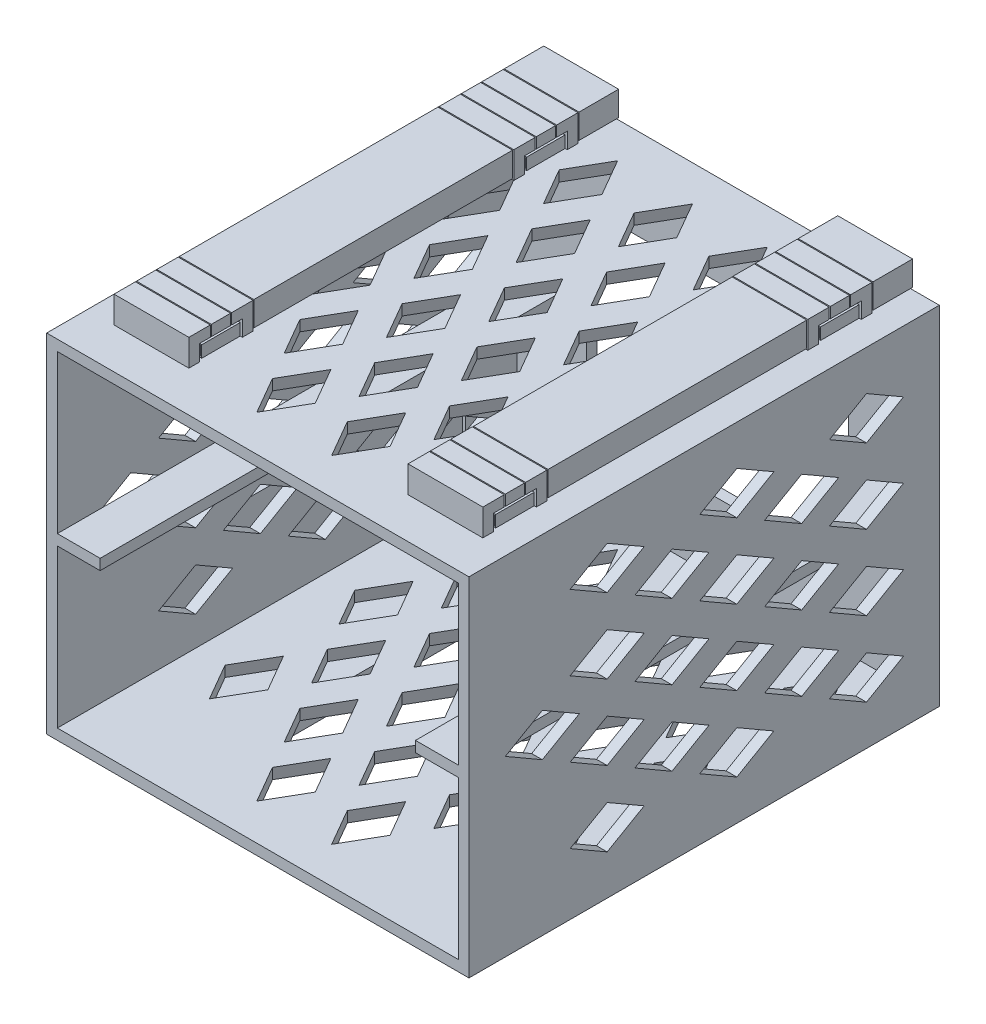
SolidWorks part; units mm, degrees
ref_plane "Alzado" through (0, 0, 0) normal (0, 0, 1) x (1, 0, 0)
ref_plane "Planta" through (0, 0, 0) normal (0, 1, 0) x (1, 0, 0)
ref_plane "Vista lateral" through (0, 0, 0) normal (1, 0, 0) x (0, 0, -1)
sketch "Croquis1" plane through (0, 0, 0) normal (0, 0, -1) x (-1, 0, 0)
  line L1 (-39.5, 32.5) -> (39.5, 32.5)
  line L2 (-39.5, 32.5) -> (-39.5, -32.5)
  line L3 (-39.5, -32.5) -> (39.5, -32.5)
  line L4 (39.5, 32.5) -> (39.5, -32.5)
  line L7 (-24.5, 17.5) -> (24.5, 17.5)
  line L8 (-24.5, 17.5) -> (-24.5, -17.5)
  line L9 (-24.5, -17.5) -> (24.5, -17.5)
  line L10 (24.5, 17.5) -> (24.5, -17.5)
extrude "Fondo" add sketch "Croquis1" against normal blind 2 separate body
sketch "Croquis3" plane through (0, 0, 2) normal (0, 0, 1) x (1, 0, 0)
  line L1 (-39.5, 32.5) -> (39.5, 32.5)
  line L2 (-39.5, 32.5) -> (-39.5, -32.5)
  line L3 (-39.5, -32.5) -> (39.5, -32.5)
  line L4 (39.5, 32.5) -> (39.5, -32.5)
  line L6 (-37.5, 30.5) -> (-37.5, -30.5)
  line L7 (-37.5, 30.5) -> (37.5, 30.5)
  line L8 (37.5, 30.5) -> (37.5, -30.5)
  line L9 (-37.5, -30.5) -> (37.5, -30.5)
extrude "Estructura" add sketch "Croquis3" along normal blind 86
sketch "Croquis5" plane through (-39.5, 0, 0) normal (-1, 0, 0) x (0, 0, 1)
  line L0 (13.628, 25) -> (20.556, 21)
  line L1 (20.556, 21) -> (13.628, 17)
  line L2 (13.628, 17) -> (6.7, 21)
  line L3 (6.7, 21) -> (13.628, 25)
  line L4 (0, -32.5) -> (0, 32.5) construction
  line L5 (88, 32.5) -> (0, 32.5) construction
  line L6 (13.628, 11) -> (20.556, 7)
  line L7 (6.7, 7) -> (13.628, 11)
  line L8 (13.628, 3) -> (6.7, 7)
  line L9 (20.556, 7) -> (13.628, 3)
  line L10 (13.628, -3) -> (20.556, -7)
  line L11 (6.7, -7) -> (13.628, -3)
  line L12 (13.628, -11) -> (6.7, -7)
  line L13 (20.556, -7) -> (13.628, -11)
  line L14 (13.628, -17) -> (20.556, -21)
  line L15 (6.7, -21) -> (13.628, -17)
  line L16 (13.628, -25) -> (6.7, -21)
  line L17 (20.556, -21) -> (13.628, -25)
  line L18 (37.884, 25) -> (44.812, 21)
  line L19 (44.812, 21) -> (37.884, 17)
  line L20 (37.884, 17) -> (30.956, 21)
  line L21 (30.956, 21) -> (37.884, 25)
  line L22 (44.812, 7) -> (37.884, 3)
  line L23 (37.884, 11) -> (44.812, 7)
  line L24 (30.956, 7) -> (37.884, 11)
  line L25 (37.884, 3) -> (30.956, 7)
  line L26 (44.812, -7) -> (37.884, -11)
  line L27 (37.884, -3) -> (44.812, -7)
  line L28 (30.956, -7) -> (37.884, -3)
  line L29 (37.884, -11) -> (30.956, -7)
  line L30 (37.884, -17) -> (44.812, -21)
  line L31 (44.812, -21) -> (37.884, -25)
  line L32 (37.884, -25) -> (30.956, -21)
  line L33 (30.956, -21) -> (37.884, -17)
  line L34 (62.14, 25) -> (69.068, 21)
  line L35 (69.068, 21) -> (62.14, 17)
  line L36 (62.14, 17) -> (55.212, 21)
  line L37 (55.212, 21) -> (62.14, 25)
  line L38 (69.068, 7) -> (62.14, 3)
  line L39 (62.14, 11) -> (69.068, 7)
  line L40 (55.212, 7) -> (62.14, 11)
  line L41 (62.14, 3) -> (55.212, 7)
  line L42 (69.068, -7) -> (62.14, -11)
  line L43 (62.14, -3) -> (69.068, -7)
  line L44 (55.212, -7) -> (62.14, -3)
  line L45 (62.14, -11) -> (55.212, -7)
  line L46 (62.14, -17) -> (69.068, -21)
  line L47 (69.068, -21) -> (62.14, -25)
  line L48 (62.14, -25) -> (55.212, -21)
  line L49 (55.212, -21) -> (62.14, -17)
  line L66 (50.012, 18) -> (56.94, 14)
  line L67 (56.94, 14) -> (50.012, 10)
  line L68 (50.012, 10) -> (43.084, 14)
  line L69 (43.084, 14) -> (50.012, 18)
  line L70 (50.012, 4) -> (56.94, 0)
  line L71 (43.084, 0) -> (50.012, 4)
  line L72 (50.012, -4) -> (43.084, 0)
  line L73 (56.94, -14) -> (50.012, -18)
  line L74 (50.012, -10) -> (56.94, -14)
  line L75 (43.084, -14) -> (50.012, -10)
  line L76 (18.828, 14) -> (25.756, 18)
  line L77 (67.34, 14) -> (74.268, 18) construction
  line L78 (67.34, -14) -> (74.268, -10) construction
  line L79 (74.268, -18) -> (67.34, -14) construction
  line L80 (25.756, 4) -> (32.684, 0)
  line L81 (18.828, 0) -> (25.756, 4)
  line L82 (25.756, -4) -> (18.828, 0)
  line L83 (32.684, 0) -> (25.756, -4)
  line L84 (25.756, -18) -> (18.828, -14)
  line L85 (32.684, -14) -> (25.756, -18)
  line L86 (56.94, 0) -> (50.012, -4)
  line L87 (50.012, -18) -> (43.084, -14)
  line L88 (32.684, 14) -> (25.756, 10)
  line L89 (25.756, 10) -> (18.828, 14)
  line L90 (25.756, 18) -> (32.684, 14)
  line L91 (74.268, 18) -> (81.196, 14) construction
  line L92 (81.196, 14) -> (74.268, 10) construction
  line L93 (74.268, 10) -> (67.34, 14) construction
  line L94 (81.196, 0) -> (74.268, -4)
  line L95 (74.268, 4) -> (81.196, 0)
  line L96 (67.34, 0) -> (74.268, 4)
  line L97 (74.268, -4) -> (67.34, 0)
  line L98 (81.196, -14) -> (74.268, -18) construction
  line L99 (74.268, -10) -> (81.196, -14) construction
  line L100 (25.756, -10) -> (32.684, -14)
  line L101 (18.828, -14) -> (25.756, -10)
  line L102 (88, 32.5) -> (0, 32.5) construction
  line L103 (86.396, 25) -> (93.324, 21)
  line L104 (93.324, 21) -> (86.396, 17)
  line L105 (86.396, 17) -> (79.468, 21)
  line L106 (79.468, 21) -> (86.396, 25)
  line L107 (93.324, 7) -> (86.396, 3)
  line L108 (86.396, 11) -> (93.324, 7)
  line L109 (79.468, 7) -> (86.396, 11)
  line L110 (86.396, 3) -> (79.468, 7)
  line L111 (93.324, -7) -> (86.396, -11)
  line L112 (86.396, -3) -> (93.324, -7)
  line L113 (79.468, -7) -> (86.396, -3)
  line L114 (86.396, -11) -> (79.468, -7)
  line L115 (86.396, -17) -> (93.324, -21)
  line L116 (93.324, -21) -> (86.396, -25)
  line L117 (86.396, -25) -> (79.468, -21)
  line L118 (79.468, -21) -> (86.396, -17)
  dimension "D1" = 7.9998
  dimension "D2" = 7.9998
  dimension "D3" = 6.7
  dimension "D4" = 7.5
  dimension "D5" = 8
  dimension "D7" = 13.856
  dimension "D9" = 24.256
  dimension "D10" = 14.5
  dimension "D11" = 24.256
  dimension "D6" = 4
  dimension "D8" = 4
extrude "RombosHor" cut sketch "Croquis5" against normal up to surface (79 mm away)
sketch "Croquis9" plane through (0, 32.5, 0) normal (0, 1, 0) x (1, 0, 0)
  line L0 (28, -6.6872) -> (24, -13.6154)
  line L1 (28, -6.6872) -> (32, -13.6154)
  line L2 (24, -13.6154) -> (28, -20.5436)
  line L3 (32, -13.6154) -> (28, -20.5436)
  line L4 (14, -6.6872) -> (10, -13.6154)
  line L5 (14, -6.6872) -> (18, -13.6154)
  line L6 (18, -13.6154) -> (14, -20.5436)
  line L7 (10, -13.6154) -> (14, -20.5436)
  line L8 (0, -6.6872) -> (-4, -13.6154)
  line L9 (0, -6.6872) -> (4, -13.6154)
  line L10 (4, -13.6154) -> (0, -20.5436)
  line L11 (-4, -13.6154) -> (0, -20.5436)
  line L12 (-14, -6.6872) -> (-18, -13.6154)
  line L13 (-14, -6.6872) -> (-10, -13.6154)
  line L14 (-10, -13.6154) -> (-14, -20.5436)
  line L15 (-18, -13.6154) -> (-14, -20.5436)
  line L16 (-28, -6.6872) -> (-32, -13.6154)
  line L17 (-28, -6.6872) -> (-24, -13.6154)
  line L18 (-24, -13.6154) -> (-28, -20.5436)
  line L19 (-32, -13.6154) -> (-28, -20.5436)
  line L20 (14, -30.9436) -> (10, -37.8718)
  line L21 (14, -30.9436) -> (18, -37.8718)
  line L22 (18, -37.8718) -> (14, -44.8)
  line L23 (10, -37.8718) -> (14, -44.8)
  line L24 (0, -30.9436) -> (-4, -37.8718)
  line L25 (0, -30.9436) -> (4, -37.8718)
  line L26 (4, -37.8718) -> (0, -44.8)
  line L27 (-4, -37.8718) -> (0, -44.8)
  line L28 (-14, -30.9436) -> (-18, -37.8718)
  line L29 (-14, -30.9436) -> (-10, -37.8718)
  line L30 (-10, -37.8718) -> (-14, -44.8)
  line L31 (-18, -37.8718) -> (-14, -44.8)
  line L32 (-28, -30.9436) -> (-32, -37.8718)
  line L33 (-28, -30.9436) -> (-24, -37.8718)
  line L34 (-24, -37.8718) -> (-28, -44.8)
  line L35 (-32, -37.8718) -> (-28, -44.8)
  line L36 (14, -55.2) -> (10, -62.1282)
  line L37 (14, -55.2) -> (18, -62.1282)
  line L38 (18, -62.1282) -> (14, -69.0564)
  line L39 (10, -62.1282) -> (14, -69.0564)
  line L40 (0, -55.2) -> (-4, -62.1282)
  line L41 (0, -55.2) -> (4, -62.1282)
  line L42 (4, -62.1282) -> (0, -69.0564)
  line L43 (-4, -62.1282) -> (0, -69.0564)
  line L44 (-14, -55.2) -> (-18, -62.1282)
  line L45 (-14, -55.2) -> (-10, -62.1282)
  line L46 (-10, -62.1282) -> (-14, -69.0564)
  line L47 (-18, -62.1282) -> (-14, -69.0564)
  line L48 (-28, -55.2) -> (-32, -62.1282)
  line L49 (-28, -55.2) -> (-24, -62.1282)
  line L50 (-24, -62.1282) -> (-28, -69.0564)
  line L51 (-32, -62.1282) -> (-28, -69.0564)
  line L68 (28, -30.9436) -> (24, -37.8718)
  line L69 (28, -30.9436) -> (32, -37.8718)
  line L70 (32, -37.8718) -> (28, -44.8)
  line L71 (24, -37.8718) -> (28, -44.8)
  line L72 (28, -55.2) -> (24, -62.1282)
  line L73 (28, -55.2) -> (32, -62.1282)
  line L74 (32, -62.1282) -> (28, -69.0564)
  line L75 (24, -62.1282) -> (28, -69.0564)
  line L80 (28, -6.6872) -> (14, -6.6872) construction
  line L81 (28, -6.6872) -> (28, -30.9436) construction
  line L83 (39.5, -88) -> (39.5, 0) construction
  line L87 (-39.5, 0) -> (39.5, 0) construction
  line L88 (17, -50.0018) -> (21, -56.93)
  line L89 (7, -67.33) -> (11, -74.2582)
  line L90 (-7, -67.33) -> (-11, -74.2582)
  line L91 (-7, -67.33) -> (-3, -74.2582)
  line L92 (-3, -74.2582) -> (-7, -81.1864)
  line L93 (-21, -67.33) -> (-25, -74.2582) construction
  line L94 (-21, -67.33) -> (-17, -74.2582) construction
  line L95 (-25, -74.2582) -> (-21, -81.1864) construction
  line L96 (21, -67.33) -> (25, -74.2582) construction
  line L97 (25, -74.2582) -> (21, -81.1864) construction
  line L98 (17, -74.2582) -> (21, -81.1864) construction
  line L99 (7, -18.8172) -> (3, -25.7454)
  line L100 (17, -25.7454) -> (21, -32.6736)
  line L101 (21, -18.8172) -> (25, -25.7454)
  line L102 (-7, -43.0736) -> (-11, -50.0018)
  line L103 (-3, -50.0018) -> (-7, -56.93)
  line L104 (-21, -43.0736) -> (-25, -50.0018)
  line L105 (-21, -43.0736) -> (-17, -50.0018)
  line L106 (-3, -25.7454) -> (-7, -32.6736)
  line L107 (-11, -25.7454) -> (-7, -32.6736)
  line L108 (-21, -18.8172) -> (-17, -25.7454)
  line L109 (-21, -18.8172) -> (-25, -25.7454)
  line L110 (-25, -25.7454) -> (-21, -32.6736)
  line L111 (21, -43.0736) -> (17, -50.0018)
  line L112 (11, -25.7454) -> (7, -32.6736)
  line L113 (7, -18.8172) -> (11, -25.7454)
  line L114 (7, -67.33) -> (3, -74.2582)
  line L115 (11, -74.2582) -> (7, -81.1864)
  line L116 (3, -74.2582) -> (7, -81.1864)
  line L117 (-11, -74.2582) -> (-7, -81.1864)
  line L118 (-17, -74.2582) -> (-21, -81.1864) construction
  line L119 (21, -67.33) -> (17, -74.2582) construction
  line L120 (7, -43.0736) -> (3, -50.0018)
  line L121 (7, -43.0736) -> (11, -50.0018)
  line L122 (11, -50.0018) -> (7, -56.93)
  line L123 (3, -50.0018) -> (7, -56.93)
  line L124 (21, -43.0736) -> (25, -50.0018)
  line L125 (25, -50.0018) -> (21, -56.93)
  line L126 (21, -18.8172) -> (17, -25.7454)
  line L127 (-7, -43.0736) -> (-3, -50.0018)
  line L128 (-11, -50.0018) -> (-7, -56.93)
  line L129 (-17, -50.0018) -> (-21, -56.93)
  line L130 (-25, -50.0018) -> (-21, -56.93)
  line L131 (-7, -18.8172) -> (-11, -25.7454)
  line L132 (-7, -18.8172) -> (-3, -25.7454)
  line L133 (-17, -25.7454) -> (-21, -32.6736)
  line L134 (3, -25.7454) -> (7, -32.6736)
  line L135 (25, -25.7454) -> (21, -32.6736)
  line L136 (18, -86.3846) -> (14, -93.3128)
  line L137 (10, -86.3846) -> (14, -93.3128)
  line L138 (4, -86.3846) -> (0, -93.3128)
  line L139 (-4, -86.3846) -> (0, -93.3128)
  line L140 (-10, -86.3846) -> (-14, -93.3128)
  line L141 (-18, -86.3846) -> (-14, -93.3128)
  line L142 (-24, -86.3846) -> (-28, -93.3128)
  line L143 (-32, -86.3846) -> (-28, -93.3128)
  line L144 (32, -86.3846) -> (28, -93.3128)
  line L145 (24, -86.3846) -> (28, -93.3128)
  line L146 (14, -79.4564) -> (10, -86.3846)
  line L147 (14, -79.4564) -> (18, -86.3846)
  line L148 (0, -79.4564) -> (-4, -86.3846)
  line L149 (0, -79.4564) -> (4, -86.3846)
  line L150 (-14, -79.4564) -> (-18, -86.3846)
  line L151 (-14, -79.4564) -> (-10, -86.3846)
  line L152 (-28, -79.4564) -> (-32, -86.3846)
  line L153 (-28, -79.4564) -> (-24, -86.3846)
  line L154 (28, -79.4564) -> (24, -86.3846)
  line L155 (28, -79.4564) -> (32, -86.3846)
  dimension "D1" = 8
  dimension "D2" = 8
  dimension "D3" = 8
  dimension "D4" = 13.8564
  dimension "D7" = 14
  dimension "D8" = 24.2564
  dimension "D9" = 6.6872
  dimension "D10" = 7.5
  dimension "D5" = 5
  dimension "D6" = 4
extrude "RombosVert" cut sketch "Croquis9" against normal up to surface (65 mm away)
sketch "Croquis8" plane through (0, 0, 2) normal (0, 0, 1) x (1, 0, 0)
  line L0 (-37.5, -30.5) -> (37.5, -30.5) construction
  line L1 (-29.5, -1) -> (-37.5, -1)
  line L2 (-29.5, -1) -> (-29.5, 1)
  line L3 (-29.5, 1) -> (-37.5, 1)
  line L4 (-37.5, -1) -> (-37.5, 1)
  line L5 (29.5, 1) -> (37.5, 1)
  line L6 (29.5, 1) -> (29.5, -1)
  line L7 (29.5, -1) -> (37.5, -1)
  line L8 (37.5, 1) -> (37.5, -1)
  dimension "D1" = 8
  dimension "D2" = 2
  dimension "D3" = 29.5
extrude "Guias" add sketch "Croquis8" along normal blind 86
sketch "Croquis10" plane through (39.5, 0, 0) normal (1, 0, 0) x (0, 0, -1)
  line L0 (-88, 32.5) -> (0, 32.5) construction
  line L1 (-12.104, -27.5) -> (-12.104, -13.5)
  line L2 (-15.104, -13.5) -> (-12.104, -13.5)
  line L3 (-15.104, -27.5) -> (-15.104, -13.5)
  line L4 (-15.104, -27.5) -> (-12.104, -27.5)
  line L5 (-88, 0) -> (0, 0) construction
  line L6 (-75.896, 27.5) -> (-75.896, 13.5)
  line L7 (-72.896, 13.5) -> (-75.896, 13.5)
  line L8 (-72.896, 27.5) -> (-72.896, 13.5)
  line L9 (0, 32.5) -> (0, -32.5) construction
  line L11 (-44, -32.5) -> (-44, 32.5) construction
  line L12 (-15.104, 27.5) -> (-12.104, 27.5)
  line L13 (-15.104, 27.5) -> (-15.104, 13.5)
  line L14 (-15.104, 13.5) -> (-12.104, 13.5)
  line L15 (-12.104, 27.5) -> (-12.104, 13.5)
  line L16 (-72.896, 27.5) -> (-75.896, 27.5)
  line L17 (-72.896, -27.5) -> (-75.896, -27.5)
  line L18 (-72.896, -27.5) -> (-72.896, -13.5)
  line L19 (-72.896, -13.5) -> (-75.896, -13.5)
  line L20 (-75.896, -27.5) -> (-75.896, -13.5)
  line L21 (-88, -32.5) -> (0, -32.5) construction
  dimension "D1" = 44
  dimension "D2" = 32.5
  dimension "D6" = 3
  dimension "D7" = 14
  dimension "D8" = 5
  dimension "D9" = 12.104
extrude "AncDer01" [suppressed] add sketch "Croquis10" along normal blind 2.5
sketch "Croquis11" [suppressed] plane through (42, 0, 0) normal (1, 0, 0) x (0, 0, -1)
  line L0 (-15.104, 13.5) -> (-12.104, 13.5) construction
  line L1 (0, 32.5) -> (0, -32.5) construction
  line L2 (-15.104, 27.5) -> (-15.104, 24.1478) construction
  line L3 (-17.104, 27.5) -> (-10.104, 27.5)
  line L4 (-17.104, 27.5) -> (-17.104, 13.5)
  line L5 (-44, 32.5) -> (-44, -32.5) construction
  line L6 (-12.104, 27.5) -> (-15.104, 27.5) construction
  line L7 (-10.104, -27.5) -> (-10.104, -13.5)
  line L8 (-17.104, 13.5) -> (-10.104, 13.5)
  line L9 (-17.104, -13.5) -> (-10.104, -13.5)
  line L10 (-88, 0) -> (0, 0) construction
  line L11 (-10.104, 27.5) -> (-10.104, 13.5)
  line L12 (-17.104, -27.5) -> (-17.104, -13.5)
  line L13 (-17.104, -27.5) -> (-10.104, -27.5)
  line L14 (-70.896, -27.5) -> (-77.896, -27.5)
  line L15 (-70.896, -27.5) -> (-70.896, -13.5)
  line L16 (-77.896, 27.5) -> (-77.896, 13.5)
  line L17 (-70.896, -13.5) -> (-77.896, -13.5)
  line L18 (-70.896, 13.5) -> (-77.896, 13.5)
  line L19 (-77.896, -27.5) -> (-77.896, -13.5)
  line L20 (-70.896, 27.5) -> (-70.896, 13.5)
  line L21 (-70.896, 27.5) -> (-77.896, 27.5)
  dimension "D1" = 44
  dimension "D2" = 88
  dimension "D3" = 7
  dimension "D4" = 2
extrude "AncDer02" [suppressed] add sketch "Croquis11" along normal blind 1.8
sketch "Croquis12" plane through (0, 32.5, 0) normal (0, 1, 0) x (1, 0, 0)
  line L1 (20.5, -9.604) -> (20.5, -7.604)
  line L2 (34.5, -7.604) -> (20.5, -7.604)
  line L3 (34.5, -9.604) -> (34.5, -7.604)
  line L4 (34.5, -9.604) -> (20.5, -9.604)
  line L5 (20.5, -19.604) -> (20.5, -17.604)
  line L6 (34.5, -17.604) -> (20.5, -17.604)
  line L7 (34.5, -19.604) -> (34.5, -17.604)
  line L8 (34.5, -19.604) -> (20.5, -19.604)
  line L10 (39.5, -44) -> (-39.5, -44) construction
  line L11 (-20.5, -78.396) -> (-20.5, -80.396)
  line L12 (-34.5, -80.396) -> (-20.5, -80.396)
  line L13 (0, -88) -> (0, 0) construction
  line L14 (-34.5, -78.396) -> (-34.5, -80.396)
  line L15 (-34.5, -78.396) -> (-20.5, -78.396)
  line L16 (-20.5, -68.396) -> (-20.5, -70.396)
  line L17 (-34.5, -70.396) -> (-20.5, -70.396)
  line L18 (-34.5, -68.396) -> (-34.5, -70.396)
  line L19 (-34.5, -68.396) -> (-20.5, -68.396)
  line L20 (34.5, -68.396) -> (20.5, -68.396)
  line L21 (-34.5, -19.604) -> (-20.5, -19.604)
  line L22 (-34.5, -19.604) -> (-34.5, -17.604)
  line L23 (-34.5, -17.604) -> (-20.5, -17.604)
  line L24 (-20.5, -19.604) -> (-20.5, -17.604)
  line L25 (-34.5, -9.604) -> (-20.5, -9.604)
  line L26 (-34.5, -9.604) -> (-34.5, -7.604)
  line L27 (-34.5, -7.604) -> (-20.5, -7.604)
  line L28 (-20.5, -9.604) -> (-20.5, -7.604)
  line L29 (34.5, -68.396) -> (34.5, -70.396)
  line L30 (34.5, -70.396) -> (20.5, -70.396)
  line L31 (20.5, -68.396) -> (20.5, -70.396)
  line L32 (34.5, -78.396) -> (20.5, -78.396)
  line L33 (34.5, -78.396) -> (34.5, -80.396)
  line L34 (34.5, -80.396) -> (20.5, -80.396)
  line L35 (20.5, -78.396) -> (20.5, -80.396)
  line L38 (-39.5, 0) -> (39.5, 0) construction
  line L39 (-39.5, -88) -> (-39.5, 0) construction
  dimension "D9" = 88
  dimension "D10" = 44
  dimension "D11" = 2
  dimension "D12" = 2
  dimension "D13" = 14
  dimension "D14" = 14
  dimension "D15" = 5
  dimension "D16" = 5
  dimension "D17" = 7.604
  dimension "D18" = 8
extrude "AncSup01" add sketch "Croquis12" along normal blind 3
sketch "Croquis13" plane through (0, 35.5, 0) normal (0, 1, 0) x (1, 0, 0)
  line L0 (39.5, -44) -> (-39.5, -44) construction
  line L2 (-39.5, 0) -> (39.5, 0) construction
  line L3 (-20.5, -9.604) -> (-20.5, -7.604) construction
  line L4 (-34.5, -7.604) -> (-20.5, -7.604)
  line L5 (-34.5, -7.604) -> (-34.5, -11.604)
  line L6 (-34.5, -11.604) -> (-20.5, -11.604)
  line L7 (-20.5, -7.604) -> (-20.5, -11.604)
  line L8 (-27.4575, -19.604) -> (-21.4543, -19.604) construction
  line L10 (-34.5, -19.604) -> (-20.5, -19.604)
  line L11 (0, 0) -> (0, -88) construction
  line L13 (-34.5, -19.604) -> (-34.5, -15.604)
  line L14 (-34.5, -15.604) -> (-20.5, -15.604)
  line L15 (-20.5, -19.604) -> (-20.5, -15.604)
  line L16 (-20.5, -19.604) -> (-20.5, -17.604) construction
  line L17 (20.5, -19.604) -> (20.5, -15.604)
  line L18 (34.5, -15.604) -> (20.5, -15.604)
  line L19 (34.5, -19.604) -> (34.5, -15.604)
  line L20 (34.5, -19.604) -> (20.5, -19.604)
  line L21 (20.5, -7.604) -> (20.5, -11.604)
  line L22 (34.5, -11.604) -> (20.5, -11.604)
  line L23 (34.5, -7.604) -> (34.5, -11.604)
  line L24 (34.5, -7.604) -> (20.5, -7.604)
  line L25 (34.5, -80.396) -> (20.5, -80.396)
  line L26 (34.5, -80.396) -> (34.5, -76.396)
  line L27 (34.5, -76.396) -> (20.5, -76.396)
  line L28 (20.5, -80.396) -> (20.5, -76.396)
  line L29 (34.5, -68.396) -> (20.5, -68.396)
  line L30 (34.5, -68.396) -> (34.5, -72.396)
  line L31 (34.5, -72.396) -> (20.5, -72.396)
  line L32 (20.5, -68.396) -> (20.5, -72.396)
  line L33 (-20.5, -68.396) -> (-20.5, -72.396)
  line L34 (-34.5, -72.396) -> (-20.5, -72.396)
  line L35 (-34.5, -68.396) -> (-34.5, -72.396)
  line L36 (-34.5, -68.396) -> (-20.5, -68.396)
  line L37 (-20.5, -80.396) -> (-20.5, -76.396)
  line L38 (-34.5, -76.396) -> (-20.5, -76.396)
  line L39 (-34.5, -80.396) -> (-34.5, -76.396)
  line L40 (-34.5, -80.396) -> (-20.5, -80.396)
  dimension "D1" = 44
  dimension "D2" = 88
  dimension "D3" = 4
  dimension "D4" = 4
extrude "AncSup02" add sketch "Croquis13" along normal blind 2
sketch "Croquis52" plane through (-39.5, 0, 0) normal (-1, 0, 0) x (0, 0, 1)
  line L0 (0, -32.5) -> (0, 32.5) construction
  line L1 (88, 32.5) -> (0, 32.5) construction
  line L2 (9.604, -27.5) -> (7.604, -27.5)
  line L3 (9.604, -27.5) -> (9.604, -13.5)
  line L4 (9.604, -13.5) -> (7.604, -13.5)
  line L5 (7.604, -27.5) -> (7.604, -13.5)
  line L6 (19.604, -27.5) -> (17.604, -27.5)
  line L7 (19.604, -27.5) -> (19.604, -13.5)
  line L8 (19.604, -13.5) -> (17.604, -13.5)
  line L9 (44, 32.5) -> (44, -32.5) construction
  line L10 (17.604, -27.5) -> (17.604, -13.5)
  line L11 (78.396, 27.5) -> (80.396, 27.5)
  line L12 (78.396, 27.5) -> (78.396, 13.5)
  line L13 (78.396, 13.5) -> (80.396, 13.5)
  line L14 (80.396, 27.5) -> (80.396, 13.5)
  line L15 (68.396, 27.5) -> (70.396, 27.5)
  line L16 (88, 0) -> (0, 0) construction
  line L17 (68.396, 27.5) -> (68.396, 13.5)
  line L18 (68.396, 13.5) -> (70.396, 13.5)
  line L19 (70.396, 27.5) -> (70.396, 13.5)
  line L20 (70.396, -27.5) -> (70.396, -13.5)
  line L21 (68.396, -13.5) -> (70.396, -13.5)
  line L22 (68.396, -27.5) -> (68.396, -13.5)
  line L23 (68.396, -27.5) -> (70.396, -27.5)
  line L24 (80.396, -27.5) -> (80.396, -13.5)
  line L25 (78.396, -13.5) -> (80.396, -13.5)
  line L26 (78.396, -27.5) -> (78.396, -13.5)
  line L27 (78.396, -27.5) -> (80.396, -27.5)
  line L32 (17.604, 27.5) -> (17.604, 13.5)
  line L33 (19.604, 13.5) -> (17.604, 13.5)
  line L34 (19.604, 27.5) -> (19.604, 13.5)
  line L35 (19.604, 27.5) -> (17.604, 27.5)
  line L36 (7.604, 27.5) -> (7.604, 13.5)
  line L37 (9.604, 13.5) -> (7.604, 13.5)
  line L38 (9.604, 27.5) -> (9.604, 13.5)
  line L39 (9.604, 27.5) -> (7.604, 27.5)
  dimension "D1" = 44
  dimension "D2" = 88
  dimension "D3" = 2
  dimension "D4" = 2
  dimension "D5" = 8
  dimension "D6" = 14
  dimension "D7" = 14
  dimension "D8" = 7.604
  dimension "D9" = 5
  dimension "D10" = 5
extrude "AncIzq01" add sketch "Croquis52" along normal blind 3
sketch "Croquis53" plane through (-42.5, 0, 0) normal (-1, 0, 0) x (0, 0, 1)
  line L0 (44, 32.5) -> (44, -32.5) construction
  line L1 (0, -32.5) -> (0, 32.5) construction
  line L2 (7.604, 13.5) -> (9.604, 13.5) construction
  line L3 (7.604, 27.5) -> (11.604, 27.5)
  line L4 (7.604, 27.5) -> (7.604, 13.5)
  line L5 (7.604, 13.5) -> (11.604, 13.5)
  line L6 (11.604, 27.5) -> (11.604, 13.5)
  line L7 (17.604, 13.5) -> (19.604, 13.5) construction
  line L8 (19.604, 27.5) -> (15.604, 27.5)
  line L10 (19.604, 27.5) -> (19.604, 13.5)
  line L12 (88, 0) -> (0, 0) construction
  line L13 (19.604, 13.5) -> (15.604, 13.5)
  line L14 (15.604, 27.5) -> (15.604, 13.5)
  line L15 (15.604, -27.5) -> (15.604, -13.5)
  line L16 (19.604, -13.5) -> (15.604, -13.5)
  line L17 (19.604, -27.5) -> (19.604, -13.5)
  line L18 (19.604, -27.5) -> (15.604, -27.5)
  line L19 (11.604, -27.5) -> (11.604, -13.5)
  line L20 (7.604, -13.5) -> (11.604, -13.5)
  line L21 (7.604, -27.5) -> (7.604, -13.5)
  line L22 (7.604, -27.5) -> (11.604, -27.5)
  line L23 (80.396, -27.5) -> (76.396, -27.5)
  line L24 (80.396, -27.5) -> (80.396, -13.5)
  line L25 (80.396, -13.5) -> (76.396, -13.5)
  line L26 (76.396, -27.5) -> (76.396, -13.5)
  line L27 (68.396, -27.5) -> (72.396, -27.5)
  line L28 (68.396, -27.5) -> (68.396, -13.5)
  line L29 (68.396, -13.5) -> (72.396, -13.5)
  line L30 (72.396, -27.5) -> (72.396, -13.5)
  line L31 (72.396, 27.5) -> (72.396, 13.5)
  line L32 (68.396, 13.5) -> (72.396, 13.5)
  line L33 (68.396, 27.5) -> (68.396, 13.5)
  line L34 (68.396, 27.5) -> (72.396, 27.5)
  line L35 (76.396, 27.5) -> (76.396, 13.5)
  line L36 (80.396, 13.5) -> (76.396, 13.5)
  line L37 (80.396, 27.5) -> (80.396, 13.5)
  line L38 (80.396, 27.5) -> (76.396, 27.5)
  dimension "D1" = 44
  dimension "D2" = 88
  dimension "D3" = 4
  dimension "D4" = 4
extrude "AncIzq02" add sketch "Croquis53" along normal blind 2
sketch "Croquis54" plane through (0, -32.5, 0) normal (0, -1, 0) x (1, 0, 0)
  line L0 (0, 88) -> (0, 0) construction
  line L1 (-34.5, 15.104) -> (-20.5, 15.104)
  line L2 (-34.5, 15.104) -> (-34.5, 12.104)
  line L3 (-34.5, 12.104) -> (-20.5, 12.104)
  line L4 (-20.5, 15.104) -> (-20.5, 12.104)
  line L5 (-39.5, 88) -> (39.5, 88) construction
  line L6 (-39.5, 44) -> (39.5, 44) construction
  line L7 (-39.5, 88) -> (-39.5, 0) construction
  line L8 (39.5, 88) -> (39.5, 0) construction
  line L9 (39.5, 0) -> (-39.5, 0) construction
  line L10 (20.5, 15.104) -> (20.5, 12.104)
  line L11 (34.5, 12.104) -> (20.5, 12.104)
  line L12 (34.5, 15.104) -> (34.5, 12.104)
  line L13 (34.5, 15.104) -> (20.5, 15.104)
  line L14 (34.5, 72.896) -> (20.5, 72.896)
  line L15 (34.5, 72.896) -> (34.5, 75.896)
  line L16 (34.5, 75.896) -> (20.5, 75.896)
  line L17 (20.5, 72.896) -> (20.5, 75.896)
  line L18 (-20.5, 72.896) -> (-20.5, 75.896)
  line L19 (-34.5, 75.896) -> (-20.5, 75.896)
  line L20 (-34.5, 72.896) -> (-34.5, 75.896)
  line L21 (-34.5, 72.896) -> (-20.5, 72.896)
  dimension "D1" = 3
  dimension "D2" = 14
  dimension "D3" = 5
  dimension "D4" = 12.104
extrude "AncInf01" add sketch "Croquis54" along normal blind 2.5
sketch "Croquis55" plane through (0, -35, 0) normal (0, -1, 0) x (1, 0, 0)
  line L1 (-34.5, 77.896) -> (-20.5, 77.896)
  line L2 (-34.5, 77.896) -> (-34.5, 70.896)
  line L3 (-34.5, 70.896) -> (-20.5, 70.896)
  line L4 (-20.5, 77.896) -> (-20.5, 70.896)
  line L6 (-20.5, 72.896) -> (-20.5, 75.896) construction
  line L7 (-34.5, 75.896) -> (-34.5, 72.896) construction
  line L8 (-34.5, 72.896) -> (-20.5, 72.896) construction
  line L9 (-39.5, 44) -> (39.5, 44) construction
  line L10 (-39.5, 88) -> (-39.5, 0) construction
  line L11 (39.5, 88) -> (39.5, 0) construction
  line L12 (0, 88) -> (0, 0) construction
  line L13 (-39.5, 88) -> (39.5, 88) construction
  line L14 (20.5, 77.896) -> (20.5, 70.896)
  line L15 (34.5, 70.896) -> (20.5, 70.896)
  line L16 (34.5, 77.896) -> (34.5, 70.896)
  line L17 (34.5, 77.896) -> (20.5, 77.896)
  line L18 (34.5, 10.104) -> (20.5, 10.104)
  line L19 (34.5, 10.104) -> (34.5, 17.104)
  line L20 (34.5, 17.104) -> (20.5, 17.104)
  line L21 (20.5, 10.104) -> (20.5, 17.104)
  line L22 (-20.5, 10.104) -> (-20.5, 17.104)
  line L23 (-34.5, 17.104) -> (-20.5, 17.104)
  line L24 (-34.5, 10.104) -> (-34.5, 17.104)
  line L25 (-34.5, 10.104) -> (-20.5, 10.104)
  dimension "D1" = 7
  dimension "D2" = 2
extrude "AncInf02" add sketch "Croquis55" along normal blind 1.8
sketch "Croquis61" plane through (0, 0, 0) normal (0, 0, -1) x (-1, 0, 0)
  line L1 (20.5, 32.9) -> (34.5, 32.9)
  line L2 (20.5, 32.9) -> (20.5, 37.5)
  line L3 (20.5, 37.5) -> (34.5, 37.5)
  line L4 (34.5, 32.9) -> (34.5, 37.5)
  line L5 (20.7, 33.1) -> (20.7, 37.3)
  line L6 (20.7, 37.3) -> (34.3, 37.3)
  line L7 (34.3, 33.1) -> (34.3, 37.3)
  line L8 (20.7, 33.1) -> (34.3, 33.1)
  line L9 (0, 32.5) -> (0, 17.5) construction
  line L10 (39.5, 32.5) -> (-39.5, 32.5) construction
  line L11 (24.5, 17.5) -> (-24.5, 17.5) construction
  line L12 (-20.7, 33.1) -> (-34.3, 33.1)
  line L13 (-34.3, 33.1) -> (-34.3, 37.3)
  line L14 (-20.7, 37.3) -> (-34.3, 37.3)
  line L15 (-20.7, 33.1) -> (-20.7, 37.3)
  line L16 (-34.5, 32.9) -> (-34.5, 37.5)
  line L17 (-20.5, 37.5) -> (-34.5, 37.5)
  line L18 (-20.5, 32.9) -> (-20.5, 37.5)
  line L19 (-20.5, 32.9) -> (-34.5, 32.9)
  dimension "D1" = 0.2
extrude "EspAncSup01" add sketch "Croquis61" against normal blind 7.404 separate body
ref_plane "PlanoEspAncSup01" through (0, 0, 19.804) normal (0, 0, 1) x (1, 0, 0)
sketch "Croquis57" plane through (0, 0, 19.804) normal (0, 0, 1) x (1, 0, 0)
  line L1 (34.5, 37.5) -> (20.5457, 37.5)
  line L2 (34.5, 37.5) -> (34.5, 32.9)
  line L3 (34.5, 32.9) -> (20.5457, 32.9)
  line L4 (20.5457, 37.5) -> (20.5457, 32.9)
  line L5 (34.3, 37.3) -> (34.3, 33.1)
  line L6 (34.3, 33.1) -> (20.7457, 33.1)
  line L7 (20.7457, 37.3) -> (20.7457, 33.1)
  line L8 (34.3, 37.3) -> (20.7457, 37.3)
  line L9 (0, 32.5) -> (0, 17.5) construction
  line L10 (-24.5, 17.5) -> (24.5, 17.5) construction
  line L11 (-34.3, 37.3) -> (-20.7457, 37.3)
  line L12 (-20.7457, 37.3) -> (-20.7457, 33.1)
  line L13 (-34.3, 33.1) -> (-20.7457, 33.1)
  line L14 (-34.3, 37.3) -> (-34.3, 33.1)
  line L15 (-20.5457, 37.5) -> (-20.5457, 32.9)
  line L16 (-34.5, 32.9) -> (-20.5457, 32.9)
  line L17 (-34.5, 37.5) -> (-34.5, 32.9)
  line L18 (-34.5, 37.5) -> (-20.5457, 37.5)
  dimension "D1" = 0.2
sketch "Croquis58" plane through (0, 0, 19.804) normal (0, 0, 1) x (1, 0, 0)
  line L0 (33.8, 36.8) -> (33.8, 33.6)
  line L1 (0, 32.5) -> (0, 17.5) construction
  line L2 (-33.6, 36.6) -> (-21.4457, 36.6)
  line L3 (-21.4457, 36.6) -> (-21.4457, 33.8)
  line L4 (-33.6, 33.8) -> (-21.4457, 33.8)
  line L5 (33.8, 33.6) -> (21.2457, 33.6)
  line L6 (21.2457, 36.8) -> (21.2457, 33.6)
  line L7 (33.8, 36.8) -> (21.2457, 36.8)
  line L8 (33.6, 36.6) -> (33.6, 33.8)
  line L9 (33.6, 33.8) -> (21.4457, 33.8)
  line L10 (21.4457, 36.6) -> (21.4457, 33.8)
  line L11 (33.6, 36.6) -> (21.4457, 36.6)
  line L12 (-33.6, 36.6) -> (-33.6, 33.8)
  line L13 (-33.8, 36.8) -> (-21.2457, 36.8)
  line L14 (-21.2457, 36.8) -> (-21.2457, 33.6)
  line L15 (-33.8, 33.6) -> (-21.2457, 33.6)
  line L16 (-33.8, 36.8) -> (-33.8, 33.6)
  dimension "D2" = 0.2
sketch "Croquis59" plane through (0, 0, 19.804) normal (0, 0, 1) x (1, 0, 0)
  line L0 (33.1, 36.1) -> (33.1, 34.3)
  line L1 (0, 32.5) -> (0, 17.5) construction
  line L2 (-32.9, 35.9) -> (-22.1457, 35.9)
  line L3 (-22.1457, 35.9) -> (-22.1457, 34.5)
  line L4 (-32.9, 34.5) -> (-22.1457, 34.5)
  line L5 (33.1, 34.3) -> (21.9457, 34.3)
  line L6 (21.9457, 36.1) -> (21.9457, 34.3)
  line L7 (33.1, 36.1) -> (21.9457, 36.1)
  line L8 (32.9, 35.9) -> (32.9, 34.5)
  line L9 (32.9, 34.5) -> (22.1457, 34.5)
  line L10 (22.1457, 35.9) -> (22.1457, 34.5)
  line L11 (32.9, 35.9) -> (22.1457, 35.9)
  line L12 (-32.9, 35.9) -> (-32.9, 34.5)
  line L13 (-33.1, 36.1) -> (-21.9457, 36.1)
  line L14 (-21.9457, 36.1) -> (-21.9457, 34.3)
  line L15 (-33.1, 34.3) -> (-21.9457, 34.3)
  line L16 (-33.1, 36.1) -> (-33.1, 34.3)
  dimension "D2" = 0.2
extrude "EspAncSup02" add sketch "Croquis57" along normal blind 48.392
extrude "EspAncSup03" add sketch "Croquis58" along normal blind 48.392 separate body
extrude "EspAncSup04" add sketch "Croquis59" along normal blind 48.392 separate body
ref_plane "PlanoEspAncSup02" through (0, 32.9, 0) normal (0, 1, 0) x (1, 0, 0)
sketch "Croquis64" plane through (0, 32.9, 0) normal (0, 1, 0) x (1, 0, 0)
  line L0 (-34.5, -9.604) -> (-29.684, -9.604) construction
  line L1 (-20.5, -17.204) -> (-34.5, -17.204)
  line L2 (-20.5, -17.204) -> (-20.5, -10.004)
  line L3 (-20.5, -10.004) -> (-34.5, -10.004)
  line L4 (-34.5, -17.204) -> (-34.5, -10.004)
  line L5 (-29.6972, -17.604) -> (-34.5, -17.604) construction
  line L6 (-34.5, -7.604) -> (-34.5, -9.604) construction
  line L7 (-39.5, -44) -> (39.5, -44) construction
  line L8 (-39.5, -88) -> (-39.5, 0) construction
  line L9 (39.5, -88) -> (39.5, 0) construction
  line L10 (0, 0) -> (0, -88) construction
  line L11 (39.5, -88) -> (-39.5, -88) construction
  line L12 (34.5, -17.204) -> (34.5, -10.004)
  line L13 (20.5, -10.004) -> (34.5, -10.004)
  line L14 (20.5, -17.204) -> (20.5, -10.004)
  line L15 (20.5, -17.204) -> (34.5, -17.204)
  line L16 (20.5, -70.796) -> (34.5, -70.796)
  line L17 (20.5, -70.796) -> (20.5, -77.996)
  line L18 (20.5, -77.996) -> (34.5, -77.996)
  line L19 (34.5, -70.796) -> (34.5, -77.996)
  line L20 (-34.5, -70.796) -> (-34.5, -77.996)
  line L21 (-20.5, -77.996) -> (-34.5, -77.996)
  line L22 (-20.5, -70.796) -> (-20.5, -77.996)
  line L23 (-20.5, -70.796) -> (-34.5, -70.796)
  dimension "D1" = 0.4
  dimension "D2" = 0.4
  dimension "D3" = 14
extrude "EspAncSup05" add sketch "Croquis64" along normal blind 2.2
sketch "Croquis66" plane through (0, 0, 17.204) normal (0, 0, 1) x (1, 0, 0)
  line L0 (-34.3, 34.9) -> (-34.3, 33.1)
  line L1 (0, 17.5) -> (0, 30.5) construction
  line L2 (-24.5, 17.5) -> (24.5, 17.5) construction
  line L3 (37.5, 30.5) -> (-37.5, 30.5) construction
  line L4 (34.3, 34.9) -> (20.7, 34.9)
  line L5 (-34.3, 33.1) -> (-20.7, 33.1)
  line L6 (-20.7, 34.9) -> (-20.7, 33.1)
  line L7 (-34.3, 34.9) -> (-20.7, 34.9)
  line L8 (20.7, 34.9) -> (20.7, 33.1)
  line L9 (34.3, 33.1) -> (20.7, 33.1)
  line L10 (34.3, 34.9) -> (34.3, 33.1)
extrude "EspAncSup06" cut sketch "Croquis66" against normal up to next (7.2 mm away)
sketch "Croquis68" plane through (0, 0, 77.996) normal (0, 0, 1) x (1, 0, 0)
  line L0 (34.3, 34.9) -> (34.3, 33.1)
  line L1 (0, 17.5) -> (0, 32.5) construction
  line L2 (-24.5, 17.5) -> (24.5, 17.5) construction
  line L3 (-34.3, 34.9) -> (-20.7, 34.9)
  line L4 (-20.7, 34.9) -> (-20.7, 33.1)
  line L5 (34.3, 33.1) -> (20.7, 33.1)
  line L6 (20.7, 34.9) -> (20.7, 33.1)
  line L7 (34.3, 34.9) -> (20.7, 34.9)
  line L8 (-34.3, 33.1) -> (-20.7, 33.1)
  line L9 (-34.3, 34.9) -> (-34.3, 33.1)
extrude "EspAncSup07" cut sketch "Croquis68" against normal up to next (7.2 mm away)
sketch "Croquis70" plane through (0, 35.5, 0) normal (0, -1, 0) x (1, 0, 0)
  line L1 (20.5, 70.396) -> (20.5, 72.396) construction
  line L2 (20.5, 72.396) -> (34.5, 72.396) construction
  line L3 (34.5, 76.396) -> (20.5, 76.396) construction
  line L4 (34.5, 72.396) -> (34.5, 70.396) construction
  line L5 (-34.5, 76.196) -> (-34.5, 72.596)
  line L6 (-20.5, 72.596) -> (-34.5, 72.596)
  line L7 (-20.5, 76.196) -> (-20.5, 72.596)
  line L8 (0, 88) -> (0, 0) construction
  line L9 (39.5, 88) -> (-39.5, 88) construction
  line L10 (39.5, 44) -> (-39.5, 44) construction
  line L11 (39.5, 88) -> (39.5, 0) construction
  line L12 (-39.5, 88) -> (-39.5, 0) construction
  line L13 (-20.5, 76.196) -> (-34.5, 76.196)
  line L14 (34.5, 11.804) -> (34.5, 15.404)
  line L15 (20.5, 15.404) -> (34.5, 15.404)
  line L16 (20.5, 11.804) -> (20.5, 15.404)
  line L17 (20.5, 76.196) -> (34.5, 76.196)
  line L18 (20.5, 76.196) -> (20.5, 72.596)
  line L19 (20.5, 72.596) -> (34.5, 72.596)
  line L20 (34.5, 76.196) -> (34.5, 72.596)
  line L21 (20.5, 11.804) -> (34.5, 11.804)
  line L22 (-20.5, 11.804) -> (-34.5, 11.804)
  line L23 (-20.5, 11.804) -> (-20.5, 15.404)
  line L24 (-20.5, 15.404) -> (-34.5, 15.404)
  line L25 (-34.5, 11.804) -> (-34.5, 15.404)
  dimension "D1" = 0.2
  dimension "D2" = 0.2
extrude "EspAncSup08" add sketch "Croquis70" against normal blind 2 separate body
sketch "Croquis71" plane through (0, 0, 72.596) normal (0, 0, -1) x (-1, 0, 0)
  line L0 (-34.3, 37.3) -> (-34.3, 35.7)
  line L2 (0, 32.5) -> (0, 17.5) construction
  line L3 (39.5, 32.5) -> (-39.5, 32.5) construction
  line L4 (24.5, 17.5) -> (-24.5, 17.5) construction
  line L5 (-20.7, 35.7) -> (-34.3, 35.7)
  line L6 (-20.7, 37.3) -> (-20.7, 35.7)
  line L7 (-20.7, 37.3) -> (-34.3, 37.3)
  line L8 (20.7, 37.3) -> (34.3, 37.3)
  line L9 (20.7, 37.3) -> (20.7, 35.7)
  line L10 (20.7, 35.7) -> (34.3, 35.7)
  line L11 (34.3, 37.3) -> (34.3, 35.7)
extrude "EspAncSup09" cut sketch "Croquis71" against normal up to next (3.6 mm away)
sketch "Croquis72" plane through (0, 0, 11.804) normal (0, 0, -1) x (-1, 0, 0)
  line L0 (-34.3, 37.3) -> (-34.3, 35.7)
  line L1 (0, 32.5) -> (0, 17.5) construction
  line L2 (39.5, 32.5) -> (-39.5, 32.5) construction
  line L3 (24.5, 17.5) -> (-24.5, 17.5) construction
  line L4 (34.3, 37.3) -> (20.7, 37.3)
  line L5 (-34.3, 35.7) -> (-20.7, 35.7)
  line L6 (-20.7, 37.3) -> (-20.7, 35.7)
  line L7 (-34.3, 37.3) -> (-20.7, 37.3)
  line L8 (20.7, 37.3) -> (20.7, 35.7)
  line L9 (34.3, 35.7) -> (20.7, 35.7)
  line L10 (34.3, 37.3) -> (34.3, 35.7)
extrude "EspAncSup10" cut sketch "Croquis72" against normal up to next (3.6 mm away)
sketch "Croquis73" plane through (0, 0, 0) normal (0, 0, -1) x (-1, 0, 0)
  line L1 (39.9, 27.5) -> (44.5, 27.5)
  line L2 (39.9, 27.5) -> (39.9, 13.5)
  line L3 (39.9, 13.5) -> (44.5, 13.5)
  line L4 (44.5, 27.5) -> (44.5, 13.5)
  line L6 (39.5, 0) -> (24.5, 0) construction
  line L7 (39.5, -32.5) -> (39.5, 32.5) construction
  line L8 (24.5, -17.5) -> (24.5, 17.5) construction
  line L9 (40.1, -27.3) -> (40.1, -13.7)
  line L10 (40.1, -13.7) -> (44.3, -13.7)
  line L11 (44.3, -27.3) -> (44.3, -13.7)
  line L12 (40.1, -27.3) -> (44.3, -27.3)
  line L13 (40.1, 27.3) -> (44.3, 27.3)
  line L14 (44.3, 27.3) -> (44.3, 13.7)
  line L15 (40.1, 13.7) -> (44.3, 13.7)
  line L16 (40.1, 27.3) -> (40.1, 13.7)
  line L17 (44.5, -27.5) -> (44.5, -13.5)
  line L18 (39.9, -13.5) -> (44.5, -13.5)
  line L19 (39.9, -27.5) -> (39.9, -13.5)
  line L20 (39.9, -27.5) -> (44.5, -27.5)
  dimension "D1" = 0.2
extrude "EspAncIzq01" add sketch "Croquis73" against normal blind 7.404 separate body
sketch "Croquis74" plane through (0, 0, 19.804) normal (0, 0, 1) x (1, 0, 0)
  line L1 (-39.9, 27.5) -> (-44.5, 27.5)
  line L2 (-39.9, 27.5) -> (-39.9, 13.5)
  line L3 (-39.9, 13.5) -> (-44.5, 13.5)
  line L4 (-44.5, 27.5) -> (-44.5, 13.5)
  line L5 (-40.1, 27.3) -> (-44.3, 27.3)
  line L6 (-44.3, 27.3) -> (-44.3, 13.7)
  line L7 (-40.1, 13.7) -> (-44.3, 13.7)
  line L8 (-40.1, 27.3) -> (-40.1, 13.7)
  line L9 (-39.5, 0) -> (-24.5, 0) construction
  line L10 (-39.5, 32.5) -> (-39.5, -32.5) construction
  line L11 (-24.5, -17.5) -> (-24.5, 17.5) construction
  line L12 (-40.1, -27.3) -> (-40.1, -13.7)
  line L13 (-40.1, -13.7) -> (-44.3, -13.7)
  line L14 (-44.3, -27.3) -> (-44.3, -13.7)
  line L15 (-40.1, -27.3) -> (-44.3, -27.3)
  line L16 (-44.5, -27.5) -> (-44.5, -13.5)
  line L17 (-39.9, -13.5) -> (-44.5, -13.5)
  line L18 (-39.9, -27.5) -> (-39.9, -13.5)
  line L19 (-39.9, -27.5) -> (-44.5, -27.5)
  dimension "D1" = 0.2
sketch "Croquis75" plane through (0, 0, 19.804) normal (0, 0, 1) x (1, 0, 0)
  line L0 (-40.6, 26.8) -> (-40.6, 14.2)
  line L1 (-39.5, 0) -> (-24.5, 0) construction
  line L2 (-40.8, -26.6) -> (-40.8, -14.4)
  line L3 (-40.8, -14.4) -> (-43.6, -14.4)
  line L4 (-43.6, -26.6) -> (-43.6, -14.4)
  line L5 (-40.6, 14.2) -> (-43.8, 14.2)
  line L6 (-43.8, 26.8) -> (-43.8, 14.2)
  line L7 (-40.6, 26.8) -> (-43.8, 26.8)
  line L8 (-40.8, 26.6) -> (-43.6, 26.6)
  line L9 (-43.6, 26.6) -> (-43.6, 14.4)
  line L10 (-40.8, 14.4) -> (-43.6, 14.4)
  line L11 (-40.8, 26.6) -> (-40.8, 14.4)
  line L12 (-40.8, -26.6) -> (-43.6, -26.6)
  line L13 (-40.6, -26.8) -> (-43.8, -26.8)
  line L14 (-43.8, -26.8) -> (-43.8, -14.2)
  line L15 (-40.6, -14.2) -> (-43.8, -14.2)
  line L16 (-40.6, -26.8) -> (-40.6, -14.2)
  dimension "D2" = 0.2
sketch "Croquis76" plane through (0, 0, 19.804) normal (0, 0, 1) x (1, 0, 0)
  line L0 (-41.3, 26.1) -> (-41.3, 14.9)
  line L1 (-39.5, 0) -> (-24.5, 0) construction
  line L2 (-41.5, -25.9) -> (-42.9, -25.9)
  line L3 (-42.9, -25.9) -> (-42.9, -15.1)
  line L4 (-41.5, -15.1) -> (-42.9, -15.1)
  line L5 (-41.3, 14.9) -> (-43.1, 14.9)
  line L6 (-43.1, 26.1) -> (-43.1, 14.9)
  line L7 (-41.3, 26.1) -> (-43.1, 26.1)
  line L8 (-41.5, 25.9) -> (-41.5, 15.1)
  line L9 (-41.5, 15.1) -> (-42.9, 15.1)
  line L10 (-42.9, 25.9) -> (-42.9, 15.1)
  line L11 (-41.5, 25.9) -> (-42.9, 25.9)
  line L12 (-41.5, -25.9) -> (-41.5, -15.1)
  line L13 (-41.3, -26.1) -> (-43.1, -26.1)
  line L14 (-43.1, -26.1) -> (-43.1, -14.9)
  line L15 (-41.3, -14.9) -> (-43.1, -14.9)
  line L16 (-41.3, -26.1) -> (-41.3, -14.9)
  dimension "D2" = 0.2
extrude "EspAncIzq02" add sketch "Croquis74" along normal blind 48.392 separate body
extrude "EspAncIzq03" add sketch "Croquis75" along normal blind 48.392 separate body
extrude "EspAncIzq04" add sketch "Croquis76" along normal blind 48.392 separate body
ref_plane "PlanoEspAncIzq01" through (-39.9, 0, 0) normal (-1, 0, 0) x (0, 0, 1)
sketch "Croquis77" plane through (-39.9, 0, 0) normal (-1, 0, 0) x (0, 0, 1)
  line L1 (9.804, 13.5) -> (17.404, 13.5)
  line L2 (9.804, 13.5) -> (9.804, 27.5)
  line L3 (9.804, 27.5) -> (17.404, 27.5)
  line L4 (17.404, 13.5) -> (17.404, 27.5)
  line L5 (19.604, 27.5) -> (17.604, 27.5) construction
  line L7 (7.604, 13.5) -> (9.604, 13.5) construction
  line L8 (44, 32.5) -> (44, -32.5) construction
  line L9 (88, 32.5) -> (0, 32.5) construction
  line L10 (88, -32.5) -> (0, -32.5) construction
  line L11 (88, 0) -> (0, 0) construction
  line L12 (88, 32.5) -> (88, -32.5) construction
  line L13 (0, -32.5) -> (0, 32.5) construction
  line L14 (70.596, 13.5) -> (70.596, 27.5)
  line L15 (78.196, 27.5) -> (70.596, 27.5)
  line L16 (78.196, 13.5) -> (78.196, 27.5)
  line L17 (78.196, 13.5) -> (70.596, 13.5)
  line L18 (78.196, -13.5) -> (70.596, -13.5)
  line L19 (78.196, -13.5) -> (78.196, -27.5)
  line L20 (78.196, -27.5) -> (70.596, -27.5)
  line L21 (70.596, -13.5) -> (70.596, -27.5)
  line L22 (17.404, -13.5) -> (17.404, -27.5)
  line L23 (9.804, -27.5) -> (17.404, -27.5)
  line L24 (9.804, -13.5) -> (9.804, -27.5)
  line L25 (9.804, -13.5) -> (17.404, -13.5)
extrude "EspAncIzq05" add sketch "Croquis77" along normal blind 2.2
sketch "Croquis78" plane through (0, 0, 9.804) normal (0, 0, -1) x (-1, 0, 0)
  line L0 (41.9, 13.7) -> (41.9, 27.3)
  line L1 (39.5, 0) -> (24.5, 0) construction
  line L2 (24.5, -17.5) -> (24.5, 17.5) construction
  line L3 (41.9, -13.7) -> (40.1, -13.7)
  line L4 (40.1, -13.7) -> (40.1, -27.3)
  line L5 (41.9, 27.3) -> (40.1, 27.3)
  line L6 (40.1, 13.7) -> (40.1, 27.3)
  line L7 (41.9, 13.7) -> (40.1, 13.7)
  line L8 (41.9, -27.3) -> (40.1, -27.3)
  line L9 (41.9, -13.7) -> (41.9, -27.3)
extrude "EspAncIzq06" cut sketch "Croquis78" against normal up to next
sketch "Croquis79" plane through (0, 0, 70.596) normal (0, 0, -1) x (-1, 0, 0)
  line L0 (40.1, 27.3) -> (40.1, 13.7)
  line L1 (39.5, 0) -> (24.5, 0) construction
  line L2 (39.5, -32.5) -> (39.5, 32.5) construction
  line L3 (24.5, -17.5) -> (24.5, 17.5) construction
  line L4 (40.1, -27.3) -> (41.9, -27.3)
  line L5 (40.1, 13.7) -> (41.9, 13.7)
  line L6 (41.9, 27.3) -> (41.9, 13.7)
  line L7 (40.1, 27.3) -> (41.9, 27.3)
  line L8 (41.9, -27.3) -> (41.9, -13.7)
  line L9 (40.1, -13.7) -> (41.9, -13.7)
  line L10 (40.1, -27.3) -> (40.1, -13.7)
extrude "EspAncIzq07" cut sketch "Croquis79" against normal up to next
sketch "Croquis80" plane through (-42.5, 0, 0) normal (1, 0, 0) x (0, 0, -1)
  line L1 (-15.404, -13.5) -> (-11.804, -13.5)
  line L2 (-15.404, -13.5) -> (-15.404, -27.5)
  line L3 (-15.404, -27.5) -> (-11.804, -27.5)
  line L4 (-11.804, -13.5) -> (-11.804, -27.5)
  line L5 (-11.604, -27.5) -> (-11.604, -13.5) construction
  line L6 (-9.604, -27.5) -> (-11.604, -27.5) construction
  line L8 (-17.604, -13.5) -> (-15.604, -13.5) construction
  line L9 (-15.604, -13.5) -> (-15.604, -27.5) construction
  line L10 (-44, -32.5) -> (-44, 32.5) construction
  line L11 (-88, -32.5) -> (0, -32.5) construction
  line L12 (-88, 32.5) -> (0, 32.5) construction
  line L13 (0, 0) -> (-88, 0) construction
  line L14 (-88, 32.5) -> (-88, -32.5) construction
  line L15 (-76.196, -13.5) -> (-76.196, -27.5)
  line L16 (-72.596, -27.5) -> (-76.196, -27.5)
  line L17 (-72.596, -13.5) -> (-72.596, -27.5)
  line L18 (-72.596, -13.5) -> (-76.196, -13.5)
  line L19 (-72.596, 13.5) -> (-76.196, 13.5)
  line L20 (-72.596, 13.5) -> (-72.596, 27.5)
  line L21 (-72.596, 27.5) -> (-76.196, 27.5)
  line L22 (-76.196, 13.5) -> (-76.196, 27.5)
  line L23 (-11.804, 13.5) -> (-11.804, 27.5)
  line L24 (-15.404, 27.5) -> (-11.804, 27.5)
  line L25 (-15.404, 13.5) -> (-15.404, 27.5)
  line L26 (-15.404, 13.5) -> (-11.804, 13.5)
  dimension "D1" = 0.2
  dimension "D2" = 0.2
extrude "EspAncIzq08" add sketch "Croquis80" against normal blind 2
sketch "Croquis81" plane through (0, 0, 11.804) normal (0, 0, -1) x (-1, 0, 0)
  line L0 (44.3, -27.3) -> (44.3, -13.7)
  line L1 (39.5, 0) -> (24.5, 0) construction
  line L2 (39.5, -32.5) -> (39.5, 32.5) construction
  line L3 (24.5, -17.5) -> (24.5, 17.5) construction
  line L4 (44.3, 27.3) -> (42.7, 27.3)
  line L5 (44.3, -13.7) -> (42.7, -13.7)
  line L6 (42.7, -27.3) -> (42.7, -13.7)
  line L7 (44.3, -27.3) -> (42.7, -27.3)
  line L8 (42.7, 27.3) -> (42.7, 13.7)
  line L9 (44.3, 13.7) -> (42.7, 13.7)
  line L10 (44.3, 27.3) -> (44.3, 13.7)
extrude "EspAncIzq09" cut sketch "Croquis81" against normal up to next
sketch "Croquis82" plane through (0, 0, 72.596) normal (0, 0, -1) x (-1, 0, 0)
  line L0 (44.3, 27.3) -> (44.3, 13.7)
  line L1 (39.5, 0) -> (24.5, 0) construction
  line L2 (39.5, -32.5) -> (39.5, 32.5) construction
  line L3 (24.5, -17.5) -> (24.5, 17.5) construction
  line L4 (44.3, -27.3) -> (42.7, -27.3)
  line L5 (44.3, 13.7) -> (42.7, 13.7)
  line L6 (42.7, 27.3) -> (42.7, 13.7)
  line L7 (44.3, 27.3) -> (42.7, 27.3)
  line L8 (42.7, -27.3) -> (42.7, -13.7)
  line L9 (44.3, -13.7) -> (42.7, -13.7)
  line L10 (44.3, -27.3) -> (44.3, -13.7)
extrude "EspAncIzq10" cut sketch "Croquis82" against normal up to next
sketch "Croquis83" plane through (0, 0, 0) normal (0, 0, -1) x (-1, 0, 0)
  line L1 (34.5, -32.9) -> (20.5, -32.9)
  line L2 (34.5, -32.9) -> (34.5, -34.6)
  line L3 (34.5, -34.6) -> (20.5, -34.6)
  line L4 (20.5, -32.9) -> (20.5, -34.6)
  line L8 (-39.5, -32.5) -> (39.5, -32.5) construction
  line L9 (34.3, -33.1) -> (20.7, -33.1)
  line L10 (20.7, -33.1) -> (20.7, -34.4)
  line L11 (34.3, -34.4) -> (20.7, -34.4)
  line L12 (34.3, -33.1) -> (34.3, -34.4)
  line L13 (0, -32.5) -> (0, -17.5) construction
  line L14 (-24.5, -17.5) -> (24.5, -17.5) construction
  line L15 (-34.3, -33.1) -> (-34.3, -34.4)
  line L16 (-34.3, -34.4) -> (-20.7, -34.4)
  line L17 (-20.7, -33.1) -> (-20.7, -34.4)
  line L18 (-34.3, -33.1) -> (-20.7, -33.1)
  line L19 (-20.5, -32.9) -> (-20.5, -34.6)
  line L20 (-34.5, -34.6) -> (-20.5, -34.6)
  line L21 (-34.5, -32.9) -> (-34.5, -34.6)
  line L22 (-34.5, -32.9) -> (-20.5, -32.9)
  dimension "D1" = 0.4
  dimension "D2" = 1.7
  dimension "D3" = 14
  dimension "D4" = 0.2
extrude "EspAncInf01" add sketch "Croquis83" against normal blind 11.904 separate body
sketch "Croquis85" plane through (0, 0, 0) normal (0, 0, -1) x (-1, 0, 0)
  line L0 (0, -32.5) -> (0, -17.5) construction
  line L1 (34.3, -35.2) -> (20.7, -35.2)
  line L2 (20.7, -35.2) -> (20.7, -36.6)
  line L3 (34.3, -36.6) -> (20.7, -36.6)
  line L4 (34.3, -35.2) -> (34.3, -36.6)
  line L5 (-39.5, -32.5) -> (39.5, -32.5) construction
  line L6 (-24.5, -17.5) -> (24.5, -17.5) construction
  line L7 (20.5, -35) -> (20.5, -36.8)
  line L8 (34.5, -36.8) -> (20.5, -36.8)
  line L9 (34.5, -35) -> (34.5, -36.8)
  line L10 (34.5, -35) -> (20.5, -35)
  line L11 (-34.5, -35) -> (-20.5, -35)
  line L12 (-34.5, -35) -> (-34.5, -36.8)
  line L13 (-34.5, -36.8) -> (-20.5, -36.8)
  line L14 (-20.5, -35) -> (-20.5, -36.8)
  line L15 (-34.3, -35.2) -> (-34.3, -36.6)
  line L16 (-34.3, -36.6) -> (-20.7, -36.6)
  line L17 (-20.7, -35.2) -> (-20.7, -36.6)
  line L18 (-34.3, -35.2) -> (-20.7, -35.2)
  dimension "D1" = 0.2
extrude "EspAcnInf02" add sketch "Croquis85" against normal blind 9.904
ref_plane "PlanoEspAncInf01" through (0, 0, 15.304) normal (0, 0, 1) x (1, 0, 0)
sketch "Croquis87" plane through (0, 0, 15.304) normal (0, 0, 1) x (1, 0, 0)
  line L1 (34.5, -32.9) -> (20.5, -32.9)
  line L2 (34.5, -32.9) -> (34.5, -34.6)
  line L3 (34.5, -34.6) -> (20.5, -34.6)
  line L4 (20.5, -32.9) -> (20.5, -34.6)
  line L6 (34.3, -33.1) -> (20.7, -33.1)
  line L7 (20.7, -33.1) -> (20.7, -34.4)
  line L8 (34.3, -34.4) -> (20.7, -34.4)
  line L9 (34.3, -33.1) -> (34.3, -34.4)
  line L10 (0, -32.5) -> (0, -17.5) construction
  line L11 (-39.5, -32.5) -> (39.5, -32.5) construction
  line L12 (24.5, -17.5) -> (-24.5, -17.5) construction
  line L13 (-34.3, -33.1) -> (-34.3, -34.4)
  line L14 (-34.3, -34.4) -> (-20.7, -34.4)
  line L15 (-20.7, -33.1) -> (-20.7, -34.4)
  line L16 (-34.3, -33.1) -> (-20.7, -33.1)
  line L17 (-20.5, -32.9) -> (-20.5, -34.6)
  line L18 (-34.5, -34.6) -> (-20.5, -34.6)
  line L19 (-34.5, -32.9) -> (-34.5, -34.6)
  line L20 (-34.5, -32.9) -> (-20.5, -32.9)
  dimension "D1" = 0.2
sketch "Croquis88" plane through (0, 0, 15.304) normal (0, 0, 1) x (1, 0, 0)
  line L0 (21.1, -33.5) -> (21.1, -34)
  line L1 (0, -32.5) -> (0, -17.5) construction
  line L2 (-39.5, -32.5) -> (39.5, -32.5) construction
  line L3 (24.5, -17.5) -> (-24.5, -17.5) construction
  line L4 (-21.1, -33.5) -> (-33.9, -33.5)
  line L5 (21.1, -34) -> (33.9, -34)
  line L6 (33.9, -33.5) -> (33.9, -34)
  line L7 (21.1, -33.5) -> (33.9, -33.5)
  line L8 (-33.9, -33.5) -> (-33.9, -34)
  line L9 (-21.1, -34) -> (-33.9, -34)
  line L10 (-21.1, -33.5) -> (-21.1, -34)
extrude "EspAncInf03" add sketch "Croquis87" along normal blind 57.392 separate body
extrude "EspAncInf04" add sketch "Croquis88" along normal blind 57.392 separate body
ref_plane "PlanoEspAncInf02" through (0, 0, 17.304) normal (0, 0, 1) x (1, 0, 0)
sketch "Croquis90" plane through (0, 0, 17.304) normal (0, 0, 1) x (1, 0, 0)
  line L0 (-34.3, -35.2) -> (-34.3, -36.6)
  line L1 (-34.5, -35) -> (-20.5, -35)
  line L2 (-34.5, -35) -> (-34.5, -36.8)
  line L3 (-34.5, -36.8) -> (-20.5, -36.8)
  line L4 (-20.5, -35) -> (-20.5, -36.8)
  line L5 (-34.3, -36.6) -> (-20.7, -36.6)
  line L6 (-20.7, -35.2) -> (-20.7, -36.6)
  line L7 (-34.3, -35.2) -> (-20.7, -35.2)
  line L8 (0, -32.5) -> (0, -17.5) construction
  line L9 (-39.5, -32.5) -> (39.5, -32.5) construction
  line L10 (24.5, -17.5) -> (-24.5, -17.5) construction
  line L11 (34.3, -35.2) -> (20.7, -35.2)
  line L12 (20.7, -35.2) -> (20.7, -36.6)
  line L13 (34.3, -36.6) -> (20.7, -36.6)
  line L14 (20.5, -35) -> (20.5, -36.8)
  line L15 (34.5, -36.8) -> (20.5, -36.8)
  line L16 (34.5, -35) -> (34.5, -36.8)
  line L17 (34.5, -35) -> (20.5, -35)
  line L18 (34.3, -35.2) -> (34.3, -36.6)
  dimension "D1" = 0.2
sketch "Croquis91" plane through (0, 0, 17.304) normal (0, 0, 1) x (1, 0, 0)
  line L0 (-33.9, -35.6) -> (-33.9, -36.2)
  line L1 (-33.7, -35.8) -> (-21.3, -35.8)
  line L2 (-21.3, -35.8) -> (-21.3, -36)
  line L3 (-33.7, -36) -> (-21.3, -36)
  line L4 (-33.7, -35.8) -> (-33.7, -36)
  line L5 (-33.9, -36.2) -> (-21.1, -36.2)
  line L6 (-21.1, -35.6) -> (-21.1, -36.2)
  line L7 (-33.9, -35.6) -> (-21.1, -35.6)
  line L8 (0, -32.5) -> (0, -17.5) construction
  line L9 (-39.5, -32.5) -> (39.5, -32.5) construction
  line L10 (33.9, -35.6) -> (21.1, -35.6)
  line L11 (21.1, -35.6) -> (21.1, -36.2)
  line L12 (33.9, -36.2) -> (21.1, -36.2)
  line L13 (33.7, -35.8) -> (33.7, -36)
  line L14 (33.7, -36) -> (21.3, -36)
  line L15 (21.3, -35.8) -> (21.3, -36)
  line L16 (33.7, -35.8) -> (21.3, -35.8)
  line L17 (33.9, -35.6) -> (33.9, -36.2)
  dimension "D1" = 0.2
extrude "EspAncInf05" add sketch "Croquis90" along normal blind 53.392 separate body
extrude "EspAncInf06" add sketch "Croquis91" along normal blind 53.392 separate body
sketch "Croquis93" plane through (0, 0, 0) normal (0, 0, -1) x (-1, 0, 0)
  line L1 (-39.9, -27.5) -> (-41.6, -27.5)
  line L2 (-39.9, -27.5) -> (-39.9, -13.5)
  line L3 (-39.9, -13.5) -> (-41.6, -13.5)
  line L4 (-41.6, -27.5) -> (-41.6, -13.5)
  line L6 (-40.1, -27.3) -> (-40.1, -13.7)
  line L7 (-40.1, -13.7) -> (-41.4, -13.7)
  line L8 (-41.4, -27.3) -> (-41.4, -13.7)
  line L9 (-40.1, -27.3) -> (-41.4, -27.3)
  line L10 (-24.5, 0) -> (-39.5, 0) construction
  line L12 (-24.5, 17.5) -> (-24.5, -17.5) construction
  line L13 (-40.1, 27.3) -> (-41.4, 27.3)
  line L14 (-41.4, 27.3) -> (-41.4, 13.7)
  line L15 (-40.1, 13.7) -> (-41.4, 13.7)
  line L16 (-40.1, 27.3) -> (-40.1, 13.7)
  line L17 (-41.6, 27.5) -> (-41.6, 13.5)
  line L18 (-39.9, 13.5) -> (-41.6, 13.5)
  line L19 (-39.9, 27.5) -> (-39.9, 13.5)
  line L20 (-39.9, 27.5) -> (-41.6, 27.5)
  dimension "D1" = 0.2
extrude "EspAncDer01" [suppressed] add sketch "Croquis93" against normal blind 11.904 separate body
sketch "Croquis94" plane through (0, 0, 0) normal (0, 0, -1) x (-1, 0, 0)
  line L0 (-42.2, -13.7) -> (-42.2, -27.3)
  line L1 (-42, -13.5) -> (-43.8, -13.5)
  line L2 (-42, -13.5) -> (-42, -27.5)
  line L3 (-42, -27.5) -> (-43.8, -27.5)
  line L4 (-43.8, -13.5) -> (-43.8, -27.5)
  line L5 (-42.2, -27.3) -> (-43.6, -27.3)
  line L6 (-43.6, -13.7) -> (-43.6, -27.3)
  line L7 (-42.2, -13.7) -> (-43.6, -13.7)
  line L8 (-24.5, 0) -> (-39.5, 0) construction
  line L9 (-24.5, 17.5) -> (-24.5, -17.5) construction
  line L10 (-42.2, 13.7) -> (-43.6, 13.7)
  line L11 (-43.6, 13.7) -> (-43.6, 27.3)
  line L12 (-42.2, 27.3) -> (-43.6, 27.3)
  line L13 (-43.8, 13.5) -> (-43.8, 27.5)
  line L14 (-42, 27.5) -> (-43.8, 27.5)
  line L15 (-42, 13.5) -> (-42, 27.5)
  line L16 (-42, 13.5) -> (-43.8, 13.5)
  line L17 (-42.2, 13.7) -> (-42.2, 27.3)
  dimension "D1" = 0.2
extrude "EspAncDer02" [suppressed] add sketch "Croquis94" against normal blind 9.904 separate body
ref_plane "PlanoEspAncDer01" [suppressed] through (0, 0, 15.304) normal (0, 0, 1) x (1, 0, 0)
sketch "Croquis95" [suppressed] plane through (0, 0, 15.304) normal (0, 0, 1) x (1, 0, 0)
  line L1 (39.9, -13.5) -> (41.6, -13.5)
  line L2 (39.9, -13.5) -> (39.9, -27.5)
  line L3 (39.9, -27.5) -> (41.6, -27.5)
  line L4 (41.6, -13.5) -> (41.6, -27.5)
  line L7 (41.4, -13.7) -> (41.4, -27.3)
  line L8 (40.1, -27.3) -> (41.4, -27.3)
  line L9 (40.1, -13.7) -> (40.1, -27.3)
  line L10 (40.1, -13.7) -> (41.4, -13.7)
  line L11 (39.5, 0) -> (24.5, 0) construction
  line L12 (39.5, -32.5) -> (39.5, 32.5) construction
  line L13 (24.5, 17.5) -> (24.5, -17.5) construction
  line L14 (40.1, 13.7) -> (41.4, 13.7)
  line L15 (40.1, 13.7) -> (40.1, 27.3)
  line L16 (40.1, 27.3) -> (41.4, 27.3)
  line L17 (41.4, 13.7) -> (41.4, 27.3)
  line L18 (41.6, 13.5) -> (41.6, 27.5)
  line L19 (39.9, 27.5) -> (41.6, 27.5)
  line L20 (39.9, 13.5) -> (39.9, 27.5)
  line L21 (39.9, 13.5) -> (41.6, 13.5)
  dimension "D1" = 0.2
sketch "Croquis96" [suppressed] plane through (0, 0, 15.304) normal (0, 0, 1) x (1, 0, 0)
  line L0 (40.5, -14.1) -> (40.5, -26.9)
  line L1 (39.5, 0) -> (24.5, 0) construction
  line L2 (39.5, -32.5) -> (39.5, 32.5) construction
  line L3 (40.5, 14.1) -> (41, 14.1)
  line L4 (41, 14.1) -> (41, 26.9)
  line L5 (40.5, -26.9) -> (41, -26.9)
  line L6 (41, -14.1) -> (41, -26.9)
  line L7 (40.5, -14.1) -> (41, -14.1)
  line L8 (40.5, 26.9) -> (41, 26.9)
  line L9 (40.5, 14.1) -> (40.5, 26.9)
extrude "EspAncDer03" [suppressed] add sketch "Croquis95" along normal blind 57.392 separate body
extrude "EspAncDer04" [suppressed] add sketch "Croquis96" along normal blind 57.392 separate body
ref_plane "PlanoEspAncDer02" [suppressed] through (0, 0, 17.304) normal (0, 0, 1) x (1, 0, 0)
sketch "Croquis97" [suppressed] plane through (0, 0, 17.304) normal (0, 0, 1) x (1, 0, 0)
  line L0 (43.6, 27.3) -> (43.6, 13.7)
  line L1 (43.8, 27.5) -> (42, 27.5)
  line L2 (43.8, 27.5) -> (43.8, 13.5)
  line L3 (43.8, 13.5) -> (42, 13.5)
  line L4 (42, 27.5) -> (42, 13.5)
  line L5 (43.6, 13.7) -> (42.2, 13.7)
  line L6 (42.2, 27.3) -> (42.2, 13.7)
  line L7 (43.6, 27.3) -> (42.2, 27.3)
  line L8 (39.5, 0) -> (24.5, 0) construction
  line L9 (24.5, 17.5) -> (24.5, -17.5) construction
  line L10 (43.6, -27.3) -> (42.2, -27.3)
  line L11 (42.2, -27.3) -> (42.2, -13.7)
  line L12 (43.6, -13.7) -> (42.2, -13.7)
  line L13 (42, -27.5) -> (42, -13.5)
  line L14 (43.8, -13.5) -> (42, -13.5)
  line L15 (43.8, -27.5) -> (43.8, -13.5)
  line L16 (43.8, -27.5) -> (42, -27.5)
  line L17 (43.6, -27.3) -> (43.6, -13.7)
  dimension "D1" = 0.2
sketch "Croquis98" [suppressed] plane through (0, 0, 17.304) normal (0, 0, 1) x (1, 0, 0)
  line L0 (42.6, 26.9) -> (43.2, 26.9)
  line L1 (39.5, 0) -> (24.5, 0) construction
  line L2 (42.6, -26.9) -> (42.6, -14.1)
  line L3 (42.6, -14.1) -> (43.2, -14.1)
  line L4 (43.2, -26.9) -> (43.2, -14.1)
  line L5 (43.2, 26.9) -> (43.2, 14.1)
  line L6 (42.6, 14.1) -> (43.2, 14.1)
  line L7 (42.6, 26.9) -> (42.6, 14.1)
  line L8 (42.6, -26.9) -> (43.2, -26.9)
extrude "EspAncDer05" [suppressed] add sketch "Croquis97" along normal blind 53.392 separate body
extrude "EspAncDer06" [suppressed] add sketch "Croquis98" along normal blind 53.392 separate body
